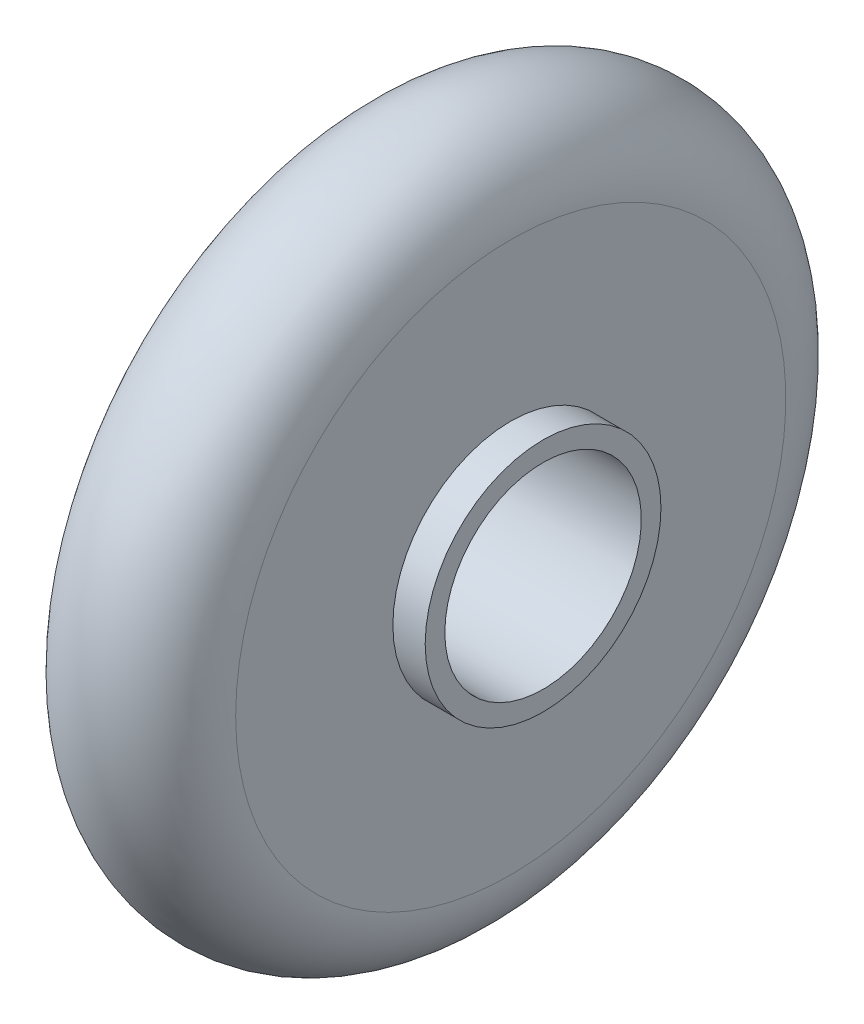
SolidWorks part; units mm, degrees
ref_plane "Plan1" through (0, 0, 0) normal (0, 0, 1) x (1, 0, 0)
ref_plane "Plan2" through (0, 0, 0) normal (0, 1, 0) x (1, 0, 0)
ref_plane "Plan3" through (0, 0, 0) normal (1, 0, 0) x (0, 0, -1)
sketch "Esquisse1" plane through (0, 0, 0) normal (0, 0, 1) x (1, 0, 0)
  line L0 (-62, 1) -> (-50.71, 1)
  line L1 (-62, 2) -> (-60.355, 2)
  line L2 (-60.355, 10) -> (-60.355, 2)
  line L3 (-52.355, 2) -> (-50.71, 2)
  line L4 (-52.355, 10) -> (-52.355, 2)
  line L7 (-62, 1) -> (-62, 2)
  line L8 (-50.71, 1) -> (-50.71, 2)
  line L9 (-66, -4) -> (-47, -4) construction
  arc A0 (-60.355, 10) -> (-52.355, 10) centre (-56.355, 10) cw
  dimension "D3" = 14
  dimension "D1" = 5
  dimension "D2" = 1
revolve "Base-Révolution" add sketch "Esquisse1" angle 360 about L9
